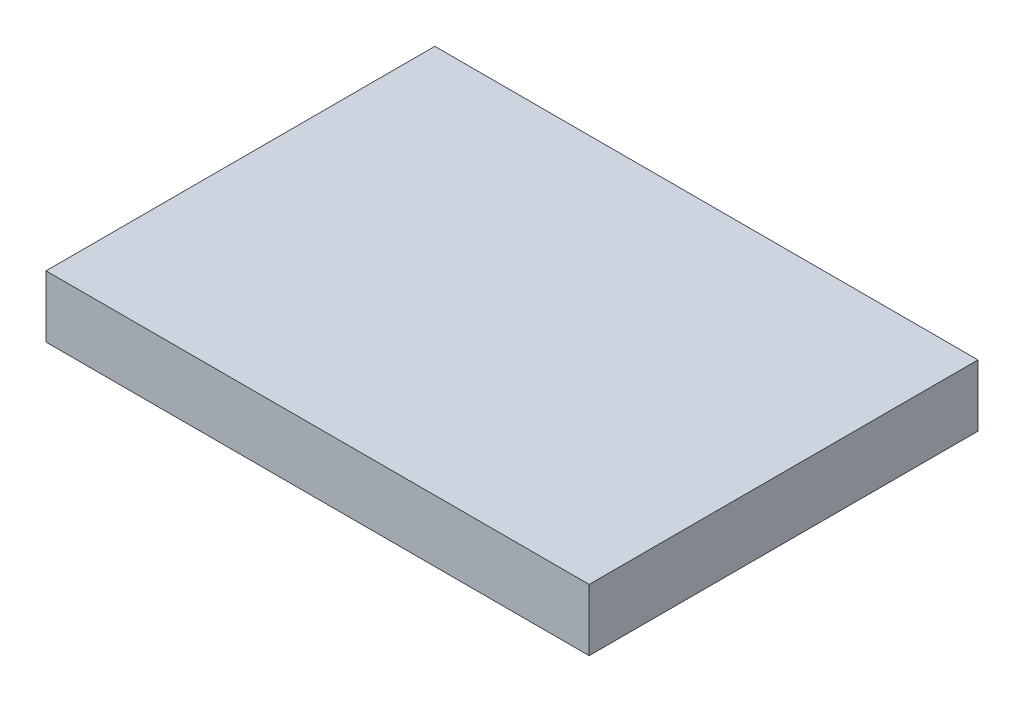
SolidWorks part; units mm, degrees
ref_plane "前视基准面" through (0, 0, 0) normal (0, 0, 1) x (1, 0, 0)
ref_plane "上视基准面" through (0, 0, 0) normal (0, 1, 0) x (1, 0, 0)
ref_plane "右视基准面" through (0, 0, 0) normal (1, 0, 0) x (0, 0, -1)
sketch "草图1" plane through (0, 0, 0) normal (0, 1, 0) x (1, 0, 0)
  line L1 (-44, -31.5) -> (44, -31.5)
  line L2 (-44, -31.5) -> (-44, 31.5)
  line L3 (-44, 31.5) -> (44, 31.5)
  line L4 (44, -31.5) -> (44, 31.5)
  line L5 (-44, -31.5) -> (44, 31.5) construction
  line L6 (-44, 31.5) -> (44, -31.5) construction
  point P0 (0, 0)
  dimension "D1" = 88
  dimension "D2" = 63
extrude "凸台-拉伸1" add sketch "草图1" along normal blind 10
